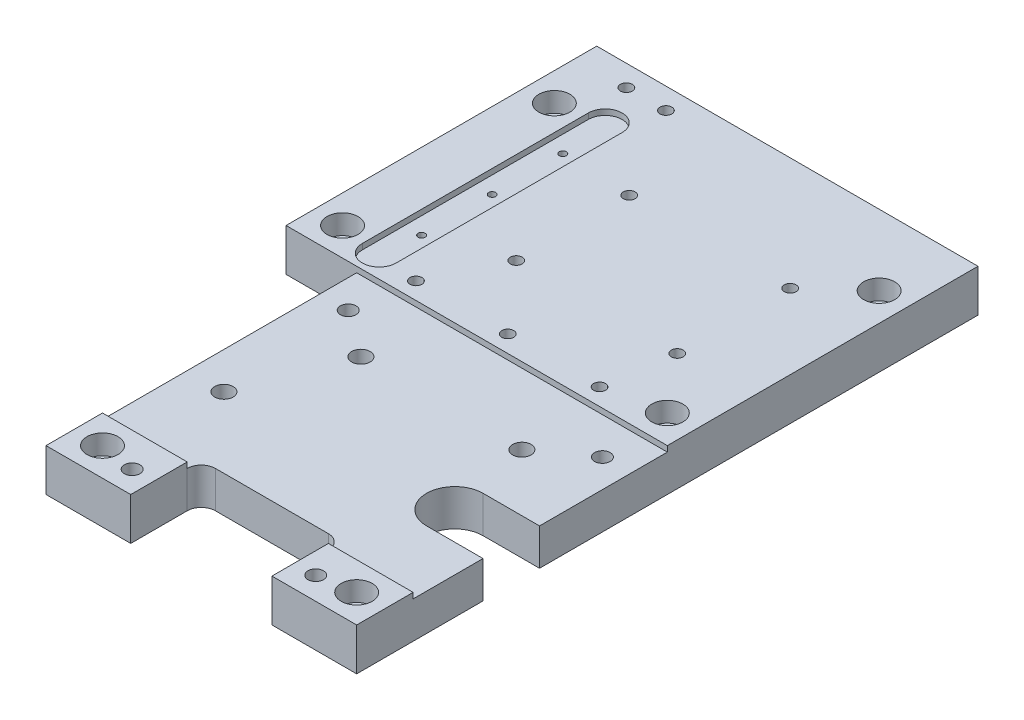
SolidWorks part; units mm, degrees
ref_plane "前视基准面" through (0, 0, 0) normal (0, 0, 1) x (1, 0, 0)
ref_plane "上视基准面" through (0, 0, 0) normal (0, 1, 0) x (1, 0, 0)
ref_plane "右视基准面" through (0, 0, 0) normal (1, 0, 0) x (0, 0, -1)
sketch "草图1" plane through (0, 0, 0) normal (0, 0, 1) x (1, 0, 0)
  line L0 (0, 15) -> (135, 15)
  line L1 (0, 0) -> (135, 0)
  line L2 (135, 0) -> (135, 15)
  line L3 (0, 0) -> (0, 15)
extrude "凸台-拉伸1" add sketch "草图1" along normal blind 220
sketch "草图2" plane through (135, 0, 0) normal (1, 0, 0) x (0, 0, -1)
  line L0 (-200, 13) -> (-200, 15)
  line L1 (-220, 0) -> (-220, 15)
  line L2 (-200, 13) -> (-110, 13)
  line L3 (-220, 15) -> (-200, 15)
  line L4 (-220, 0) -> (0, 0)
  line L5 (0, 0) -> (0, 15)
  line L6 (-110, 13) -> (-110, 15)
  line L7 (-110, 15) -> (0, 15)
extrude "切除-拉伸1" cut sketch "草图2" against normal blind 220 flip side to cut
sketch "草图3" plane through (0, 15, 0) normal (0, 1, 0) x (1, 0, 0)
  line L0 (25, -220) -> (55, -220)
  line L1 (0, 0) -> (135, 0)
  line L2 (25, -220) -> (25, -110)
  line L3 (135, -220) -> (135, -175.25)
  line L4 (0, -110) -> (25, -110)
  line L5 (0, -110) -> (0, 0)
  line L6 (55, -200) -> (55, -220)
  line L7 (105, -200) -> (105, -220)
  line L8 (60, -195) -> (100, -195)
  line L9 (105, -220) -> (135, -220)
  line L10 (115, -155.25) -> (135, -155.25)
  line L11 (115, -175.25) -> (135, -175.25)
  line L12 (135, -155.25) -> (135, 0)
  circle A0 centre (47.5, -212) radius 2.75
  circle A1 centre (112.5, -212) radius 2.75
  circle A2 centre (125, -123) radius 2.75
  circle A3 centre (35, -123) radius 2.75
  circle A4 centre (51.5, -40) radius 2.1
  circle A5 centre (108.5, -40) radius 2.1
  circle A6 centre (108.5, -80) radius 2.1
  circle A7 centre (51.5, -80) radius 2.1
  circle A8 centre (25, -87) radius 1.25
  circle A9 centre (25, -62) radius 1.25
  circle A10 centre (25, -37) radius 1.25
  circle A11 centre (18, -7.5) radius 2.1
  circle A12 centre (32, -7.5) radius 2.1
  circle A13 centre (10, -25) radius 3.25
  circle A14 centre (10, -100) radius 3.25
  circle A15 centre (125, -100) radius 3.25
  circle A16 centre (125, -25) radius 3.25
  circle A17 centre (35, -210) radius 3.25
  circle A18 centre (125, -210) radius 3.25
  circle A19 centre (51.5, -135) radius 3.25
  circle A20 centre (108.5, -135) radius 3.25
  circle A21 centre (38, -170) radius 3.25
  circle A22 centre (105, -104) radius 2.1
  circle A23 centre (72.5, -104) radius 2.1
  circle A24 centre (40, -104) radius 2.1
  arc A25 (60, -195) -> (55, -200) centre (60, -200) ccw
  arc A26 (105, -200) -> (100, -195) centre (100, -200) ccw
  arc A27 (115, -155.25) -> (115, -175.25) centre (115, -165.25) ccw
extrude "切除-拉伸2" cut sketch "草图3" against normal blind 220 flip side to cut
sketch "草图4" plane through (0, 15, 0) normal (0, 1, 0) x (1, 0, 0)
  circle A0 centre (10, -25) radius 5.5
  circle A1 centre (10, -100) radius 5.5
  circle A2 centre (125, -100) radius 5.5
  circle A3 centre (125, -25) radius 5.5
  circle A4 centre (35, -210) radius 5.5
  circle A5 centre (125, -210) radius 5.5
extrude "切除-拉伸3" cut sketch "草图4" against normal blind 7
sketch "草图5" plane through (0, 15, 0) normal (0, 1, 0) x (1, 0, 0)
  line L0 (19, -102) -> (19, -22)
  line L1 (31, -102) -> (31, -22)
  arc A0 (31, -22) -> (19, -22) centre (25, -22) ccw
  arc A1 (19, -102) -> (31, -102) centre (25, -102) ccw
extrude "切除-拉伸4" cut sketch "草图5" against normal blind 2
sketch "草图6" plane through (0, 13, 0) normal (0, 1, 0) x (1, 0, 0)
  circle A0 centre (47.5, -212) radius 4.75 construction
  circle A1 centre (112.5, -212) radius 4.75 construction
  circle A2 centre (125, -123) radius 4.75 construction
  circle A3 centre (35, -123) radius 4.75 construction
  circle A4 centre (51.5, -135) radius 5.5 construction
  circle A5 centre (108.5, -135) radius 5.5 construction
  circle A6 centre (38, -170) radius 5.5 construction
sketch "草图7" plane through (0, 0, 0) normal (0, -1, 0) x (1, 0, 0)
  circle A0 centre (51.5, 135) radius 5.5
  circle A1 centre (35, 123) radius 4.75
  circle A2 centre (38, 170) radius 5.5
  circle A3 centre (125, 123) radius 4.75
  circle A4 centre (108.5, 135) radius 5.5
  circle A5 centre (112.5, 212) radius 4.7988
  circle A6 centre (47.5, 212) radius 4.75
extrude "切除-拉伸5" cut sketch "草图7" against normal blind 6
